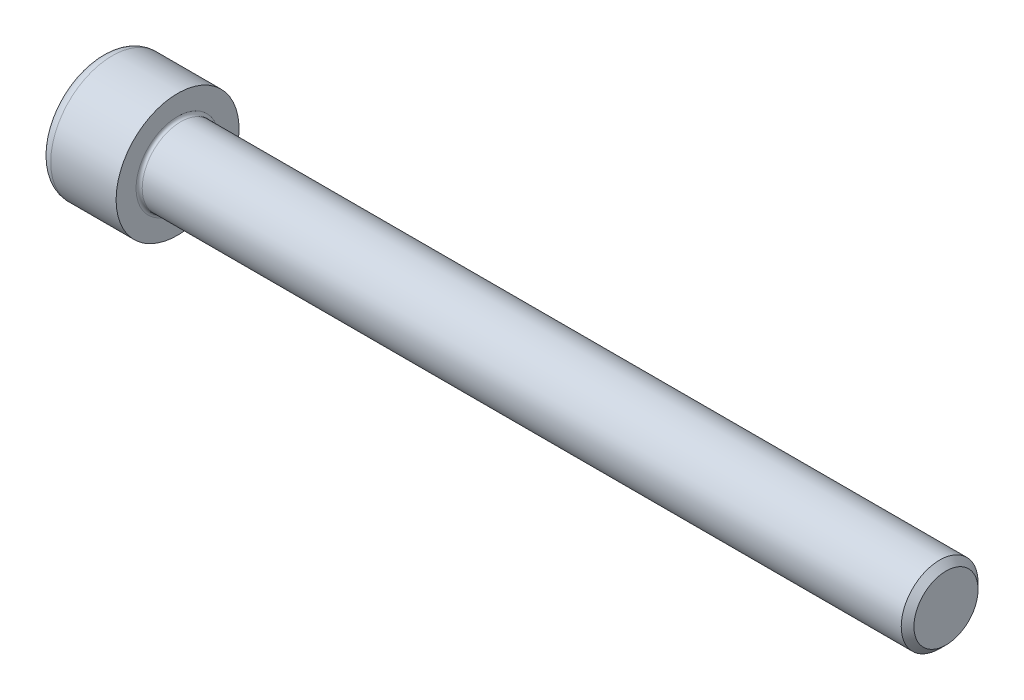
SolidWorks part; units mm, degrees
revolve "Base-Revolve" add sketch "BodySke"
sketch "BodySke" plane through (0, 0, 0) normal (0, 0, 1) x (1, 0, 0)
  line L0 (0, 0) -> (0, 8)
  line L1 (0, 8) -> (10, 8)
  line L2 (10, 8) -> (10, 5)
  line L3 (10, 5) -> (109.172, 5)
  line L4 (110, 4.172) -> (110, 0)
  line L5 (110, 0) -> (0, 0)
  line L6 (-31.75, 0) -> (127, 0) construction
  line L8 (110, 4.172) -> (109.172, 5)
  line L10 (110, -4.172) -> (109.172, -5) construction
  line L11 (11.5, 9.525) -> (11.5, 3.175) construction
  line L12 (78, 9.525) -> (78, 3.175) construction
  line L13 (50, 9.525) -> (50, 3.175) construction
fillet "Fillet1" radius 0.4 1 edges at (10, 0, 5)
fillet "Fillet2" radius 1.5 1 edges at (0, 0, 8)
ref_plane "Plane1" through (0, 0, 0) normal (0, 0, 1) x (1, 0, 0)
ref_plane "Plane2" through (0, 0, 0) normal (0, 1, 0) x (1, 0, 0)
ref_plane "Plane3" through (0, 0, 0) normal (1, 0, 0) x (0, 0, -1)
sketch "Sketch2" plane through (0, 0, 0) normal (0, 0, 1) x (1, 0, 0)
  line L0 (0, 4.0575) -> (5, 4.0575)
  line L1 (5, 4.0575) -> (7.3426, 0)
  line L2 (-31.75, 0) -> (127, 0) construction
  line L3 (7.3426, 0) -> (0, 0)
  line L4 (0, 0) -> (0, 4.0575)
  line L6 (0, 0) -> (47.625, 0) construction
revolve "Hex-PreBroach" cut sketch "Sketch2" angle 360 about L6
sketch "Sketch3" plane through (0, 0, 0) normal (-1, 0, 0) x (0, 0.5, 0.866)
  line L0 (2.3426, 4.0575) -> (-2.3426, 4.0575)
  line L1 (-2.3426, 4.0575) -> (-4.6852, 0)
  line L2 (2.3426, 4.0575) -> (4.6852, 0)
  line L3 (2.3426, -4.0575) -> (4.6852, 0)
  line L4 (2.3426, -4.0575) -> (-2.3426, -4.0575)
  line L5 (-2.3426, -4.0575) -> (-4.6852, 0)
extrude "Hex" cut sketch "Sketch3" against normal blind 5
sketch "ThdSchSke" plane through (0, 0, 0) normal (0, 0, 1) x (1, 0, 0)
  line L0 (78, -4.172) -> (77.4202, -5)
  line L1 (78, -4.172) -> (78.5798, -5)
  line L2 (78.5798, -5) -> (78.5798, -6.25)
  line L3 (-3.175, 0) -> (5.1513, 0) construction
  line L4 (0, 6.5) -> (0, -6.5) construction
  line L5 (78.5798, -6.25) -> (77.4202, -6.25)
  line L6 (77.4202, -6.25) -> (77.4202, -5)
revolve "ThreadSchematic" [suppressed] cut sketch "ThdSchSke" angle 360 about L3
pattern_linear "ThdSchPat" [suppressed]
equation "\"D2@Sketch3\" = \"Hex_size@Sketch3\" / 2"
equation "\"D1@Sketch3\" = \"Hex_size@Sketch3\" / 2"
equation "\"D1@Sketch2\" = \"Hex_size@Sketch3\" / 2"
equation "\"Thread_minor@ThreadCosmetic\"  =  \"Minor_dia@BodySke\""
equation "\"Depth@Sketch2\" =  \"Key_eng@Hex\""
equation "\"Thread_length@ThreadCosmetic\" = ((sgn( (\"Length@BodySke\" - \"Advance@BodySke\" * 3.0) - \"Thread_nom@BodySke\" )-1)*( (\"Length@BodySke\" - \"Advance@BodySke\" * 3.0) - \"Thread_nom@BodySke\" ))/-2+ \"Thread_no"
equation "\"Thread_minor@ThdSchSke\" = \"Minor_dia@BodySke\""
equation "\"Diameter@ThdSchSke\" = \"Diameter@BodySke\""
equation "\"Overcut@ThdSchSke\" = \"Diameter@BodySke\" * 1.25"
equation "\"Start@ThdSchSke\" = \"Head_ht@BodySke\" + \"Length@BodySke\" - \"Thread_length@ThreadCosmetic\"  '---Non-countersunk---"
equation "\"Num_threads@ThdSchPat\" = int( \"Thread_length@ThreadCosmetic\" / \"Advance@BodySke\" + 0.999 )  + 1"
equation "\"Advance@ThdSchPat\" = \"Thread_length@ThreadCosmetic\" /  (\"Num_threads@ThdSchPat\" - 1) 'relax it"
equation "\"Num_threads@ThdSchPat\" = \"Num_threads@ThdSchPat\" - sgn( \"Num_threads@ThdSchPat\" - 1) '---chamfered tips only---"
